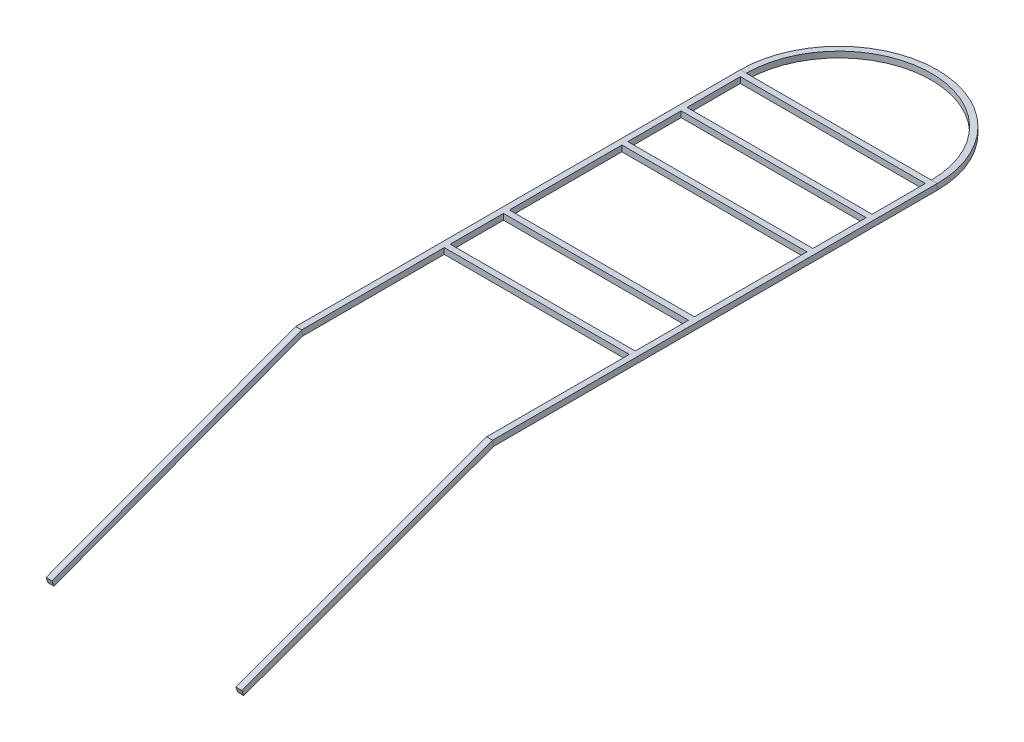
SolidWorks part; units mm, degrees
ref_plane "Piano frontale" through (0, 0, 0) normal (0, 0, 1) x (1, 0, 0)
ref_plane "Piano superiore" through (0, 0, 0) normal (0, 1, 0) x (1, 0, 0)
ref_plane "Piano destro" through (0, 0, 0) normal (1, 0, 0) x (0, 0, -1)
sketch3d "Schizzo3D3"
  line L0 (0, 0, 0) -> (0, 0, -300)
  line L1 (-129, 0, -300) -> (-129, 0, 0)
  line L3 (0, 0, 0) -> (0, -61.5636, 169.1447)
  line L4 (0, -61.5636, 169.1447) -> (-256.3584, -61.5636, 169.1447) construction
  line L5 (-129, 0, 0) -> (-128.1792, -61.5636, 169.1447)
  arc A0 (-129, 0, -300) -> (0, 0, -300) centre (-64.5, 0, -300) ccw
  point P8 (-64.5, -64.5, -300)
  point P16 (0, 0, 0)
  point P20 (-129, 0, 0)
  dimension "D4" = 180
  dimension "D1" = 300
  dimension "D2" = 129
  dimension "D3" = 20
  dimension "D5" = 180.0019
ref_plane "Piano5" through (0, -61.5636, 169.1447) normal (0, -0.342, 0.9397) x (1, 0, 0)
sketch "Schizzo9" plane through (0, -61.5636, 169.1447) normal (0, -0.342, 0.9397) x (1, 0, 0)
  line L1 (-2, -2) -> (2, -2)
  line L2 (-2, -2) -> (-2, 2)
  line L3 (-2, 2) -> (2, 2)
  line L4 (2, -2) -> (2, 2)
  line L5 (-2, -2) -> (2, 2) construction
  line L6 (-2, 2) -> (2, -2) construction
  point P0 (0, 0)
  dimension "D1" = 4
  dimension "D2" = 4
sweep "Sweep4" add profiles "Schizzo9" path "Schizzo3D3"
sketch "Schizzo10" plane through (-2, 0, 0) normal (-1, 0, 0) x (0, 0, 1)
  line L1 (-296, -2) -> (-300, -2)
  line L2 (-296, -2) -> (-296, 2)
  line L3 (-296, 2) -> (-300, 2)
  line L4 (-300, -2) -> (-300, 2)
  line L5 (-296, -2) -> (-300, 2) construction
  line L6 (-296, 2) -> (-300, -2) construction
  point P0 (-298, 0)
  dimension "D1" = 4
  dimension "D2" = 4
extrude "Estrusione-Estrusione2" add sketch "Schizzo10" along normal up to surface (125 mm away)
pattern_linear "Ripetizione a L4" count 6 spacing 40 along (0, 0, 1) of "Estrusione-Estrusione2"
